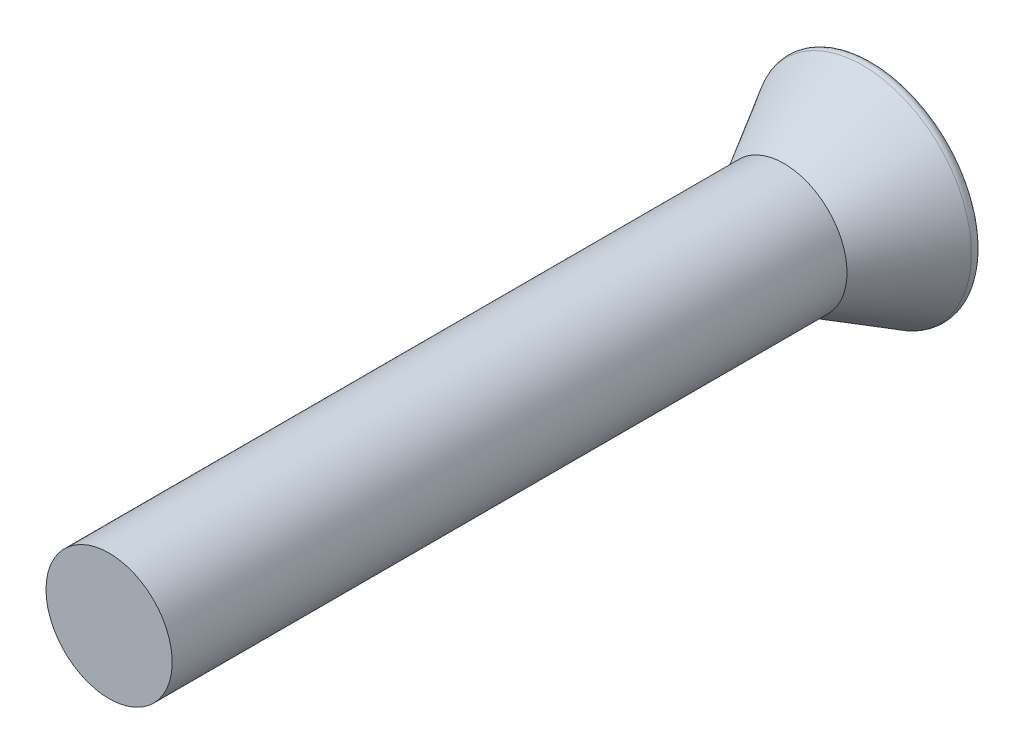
SolidWorks part; units mm, degrees
ref_plane "Front" through (0, 0, 0) normal (0, 0, 1) x (1, 0, 0)
ref_plane "Top" through (0, 0, 0) normal (0, 1, 0) x (1, 0, 0)
ref_plane "Right" through (0, 0, 0) normal (1, 0, 0) x (0, 0, -1)
sketch "Logo3_Revol_Axis" plane through (0, 0, 0) normal (0, 1, 0) x (1, 0, 0)
  line L0 (0, -43.5172) -> (0, 43.5172) construction
sketch "Logo3_bib1" plane through (0, 0, 0) normal (0, -1, 0) x (-1, 0, 0)
  line L0 (1.3557, -0.1181) -> (0.7874, -1.1024)
  line L1 (0, 0) -> (0, -9.525)
  line L2 (0, -43.5172) -> (0, 43.5172) construction
  line L3 (0, 0) -> (1.2875, 0)
  line L6 (0, -1.1024) -> (0.7874, -1.1024) construction
  line L7 (0, -9.525) -> (0.7874, -9.525)
  line L8 (0.7874, -1.1024) -> (0.7874, -9.525)
  line L10 (0, 16.5468) -> (0, -90.6614) construction
  arc A0 (1.2875, 0) -> (1.3557, -0.1181) centre (1.2875, -0.0787) cw
revolve "Revolve1" add sketch "Logo3_bib1" angle 360 about L10
sketch "Logo3_bib2" [suppressed] plane through (0, 0, 0) normal (0, 1, 0) x (1, 0, 0)
  line L0 (0, 0) -> (0, -80) construction
  line L1 (0, -30) -> (-1.5, -30)
  line L2 (-1.5, -30) -> (-1.5, -24)
  line L3 (0, 0) -> (-5.5496, 0)
  line L4 (-1.5, -24) -> (-3.5, -18.505) construction
  line L6 (-5.6795, -0.225) -> (-3.5, -4)
  line L7 (0, 0) -> (0, -30)
  line L8 (0, -4) -> (-6.3981, -4) construction
  line L12 (-3.5, -4) -> (-3.5, -18.505)
  arc A0 (-1.5, -24) -> (-3.5, -18.505) centre (-10.0486, -24) ccw
  arc A1 (-5.5496, 0) -> (-5.6795, -0.225) centre (-5.5496, -0.15) ccw
revolve "Revolve_shoulder" [suppressed] add sketch "Logo3_bib2" angle 360 about L0
equation "\"D2@Logo3_bib2\" = \"logo3_punch_d@Logo3_bib2\"/20"
equation "\"D1@Logo3_bib1\" = \"logo3_d1@Logo3_bib1\"/20"
